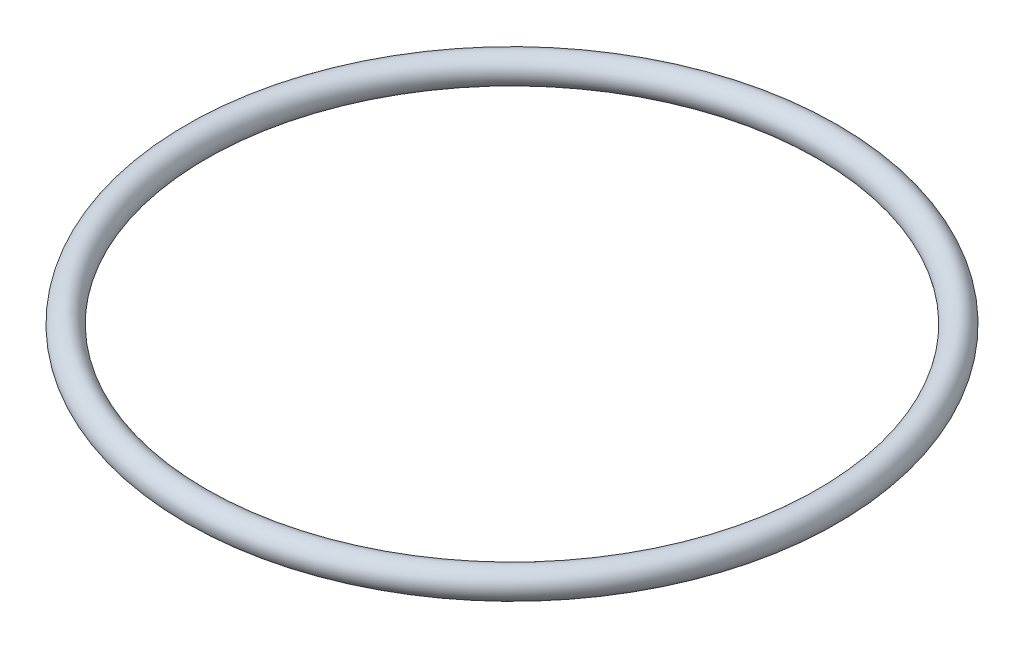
SolidWorks part; units mm, degrees
ref_plane "Face" through (0, 0, 0) normal (0, 0, 1) x (1, 0, 0)
ref_plane "Dessus" through (0, 0, 0) normal (0, 1, 0) x (1, 0, 0)
ref_plane "Côté" through (0, 0, 0) normal (1, 0, 0) x (0, 0, -1)
sketch "Esquisse1" plane through (0, 0, 0) normal (0, 0, 1) x (1, 0, 0)
  line L0 (0, 0) -> (0, 15.7513) construction
  line L1 (0, 0) -> (-8.3073, 0) construction
  circle A0 centre (-79.38, 3.495) radius 3.495
  dimension "D1" = 6.99
  dimension "D2" = 151.77
revolve "Base-Révolution" add sketch "Esquisse1" angle 360 about L0
sketch "Esquisse2" plane through (0, 0, 0) normal (0, 1, 0) x (1, 0, 0)
  circle A0 centre (0, 0) radius 6.75
  dimension "D1" = 13.5
extrude "Tronquage exter" [suppressed] cut sketch "Esquisse2" along normal through all flip side to cut
